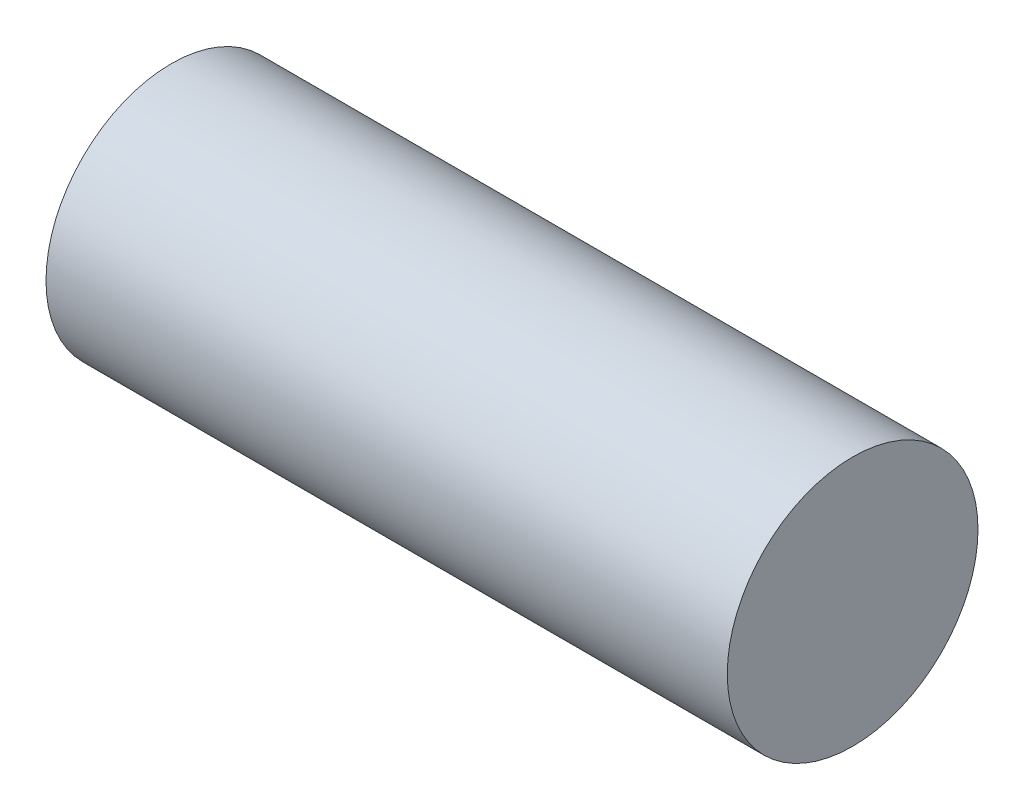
SolidWorks part; units mm, degrees
ref_plane "Front Plane" through (0, 0, 0) normal (0, 0, 1) x (1, 0, 0)
ref_plane "Top Plane" through (0, 0, 0) normal (0, 1, 0) x (1, 0, 0)
ref_plane "Right Plane" through (0, 0, 0) normal (1, 0, 0) x (0, 0, -1)
sketch "Sketch1" plane through (0, 0, 0) normal (1, 0, 0) x (0, 0, -1)
  circle A0 centre (0, 0) radius 5.842
  dimension "D1" = 11.684
extrude "Boss-Extrude1" add sketch "Sketch1" along normal blind 31.75
